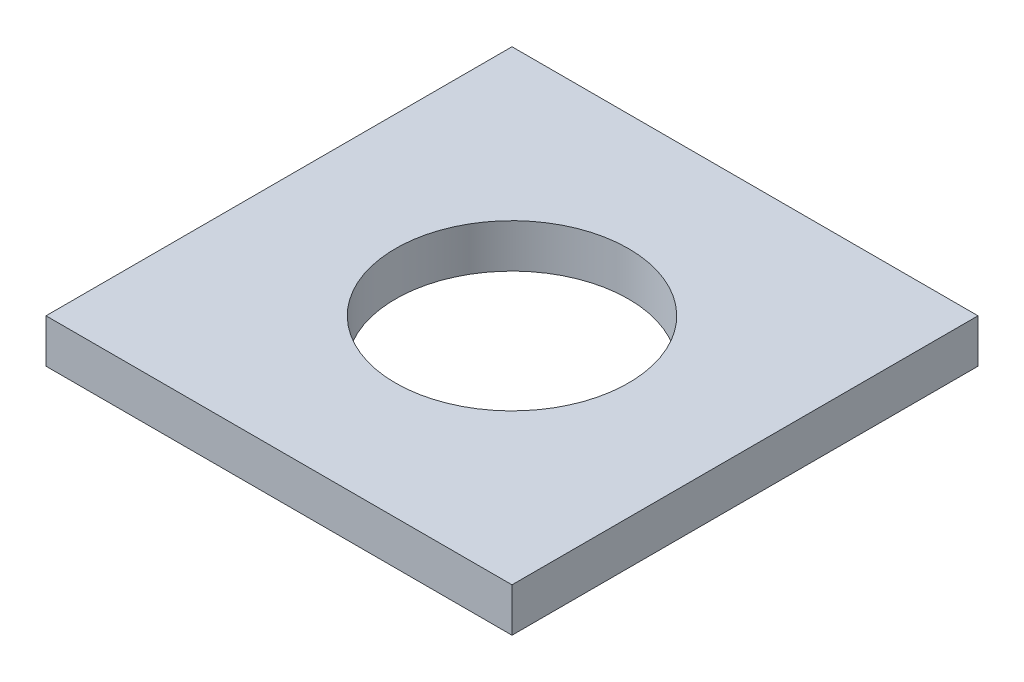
SolidWorks part; units mm, degrees
ref_plane "Front Plane" through (0, 0, 0) normal (0, 0, 1) x (1, 0, 0)
ref_plane "Top Plane" through (0, 0, 0) normal (0, 1, 0) x (1, 0, 0)
ref_plane "Right Plane" through (0, 0, 0) normal (1, 0, 0) x (0, 0, -1)
ref_plane "Plane1" through (0, 4.7625, 0) normal (0, 1, 0) x (-1, 0, 0)
sketch "Sketch1" plane through (0, 4.7625, 0) normal (0, 1, 0) x (-1, 0, 0)
  line L0 (-25.4, 25.4) -> (-25.4, -25.4)
  line L1 (-25.4, -25.4) -> (25.4, -25.4)
  line L2 (25.4, -25.4) -> (25.4, 25.4)
  line L3 (25.4, 25.4) -> (-25.4, 25.4)
  circle A0 centre (0, 0) radius 12.7
extrude "Boss-Extrude1" add sketch "Sketch1" against normal blind 4.7625
